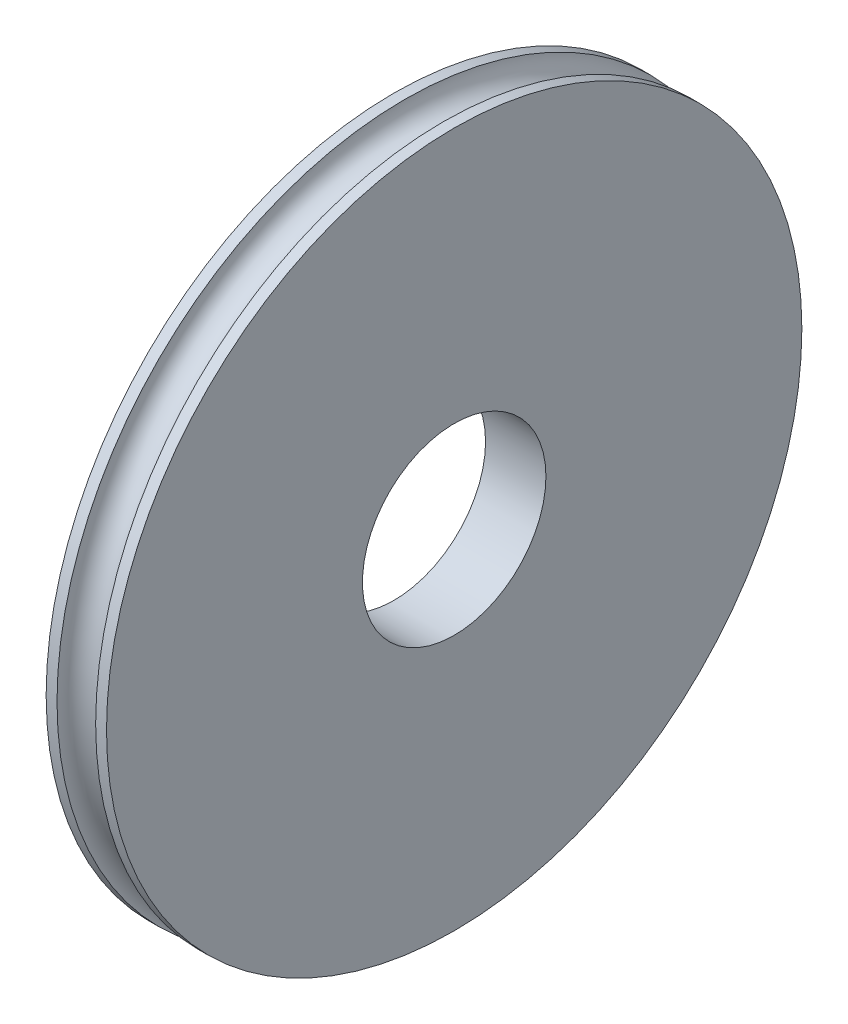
SolidWorks part; units mm, degrees
ref_plane "Front Plane" through (0, 0, 0) normal (0, 0, 1) x (1, 0, 0)
ref_plane "Top Plane" through (0, 0, 0) normal (0, 1, 0) x (1, 0, 0)
ref_plane "Right Plane" through (0, 0, 0) normal (1, 0, 0) x (0, 0, -1)
sketch "Sketch1" plane through (0, 0, 0) normal (0, 0, 1) x (1, 0, 0)
  line L0 (-3.125, 0) -> (3.125, 0)
  line L1 (-3.125, 0) -> (-3.125, 36)
  line L2 (3.125, 0) -> (3.125, 36)
  line L3 (-3.125, 36) -> (-2, 36)
  line L4 (3.125, 36) -> (2, 36)
  line L5 (-22.9962, 0) -> (22.9962, 0) construction
  arc A0 (-2, 36) -> (2, 36) centre (0, 36) ccw
  point P3 (0, 0)
  point P11 (0, 0)
  dimension "D6" = 2
  dimension "D1" = 6.25
  dimension "D2" = 36
  dimension "D3" = 36
  dimension "D4" = 1.125
  dimension "D5" = 1.125
revolve "Revolve1" add sketch "Sketch1" angle 360 about L5
hole_wizard "Ø19.0 (19) Diameter Hole1" positions "Sketch3" profile "Sketch2" hole size "Ø19.0" standard "Ansi Metric"
sketch "Sketch3" plane through (3.125, 0, 0) normal (1, 0, 0) x (0, 0, -1)
  point P0 (0, 0)
sketch "Sketch2" plane through (3.125, 0, 0) normal (0, 1, 0) x (0, 0, -1)
  line L0 (0, 0) -> (0, 6.25)
  line L1 (0, 6.25) -> (9.5, 6.25)
  line L2 (9.5, 6.25) -> (9.5, 0)
  line L5 (9.5, 0) -> (0, 0)
  line L11 (0, -6.35) -> (0, 107.95) construction
  dimension "Thru Hole Dia." = 19
  dimension "Thru Hole Depth" = 6.25
